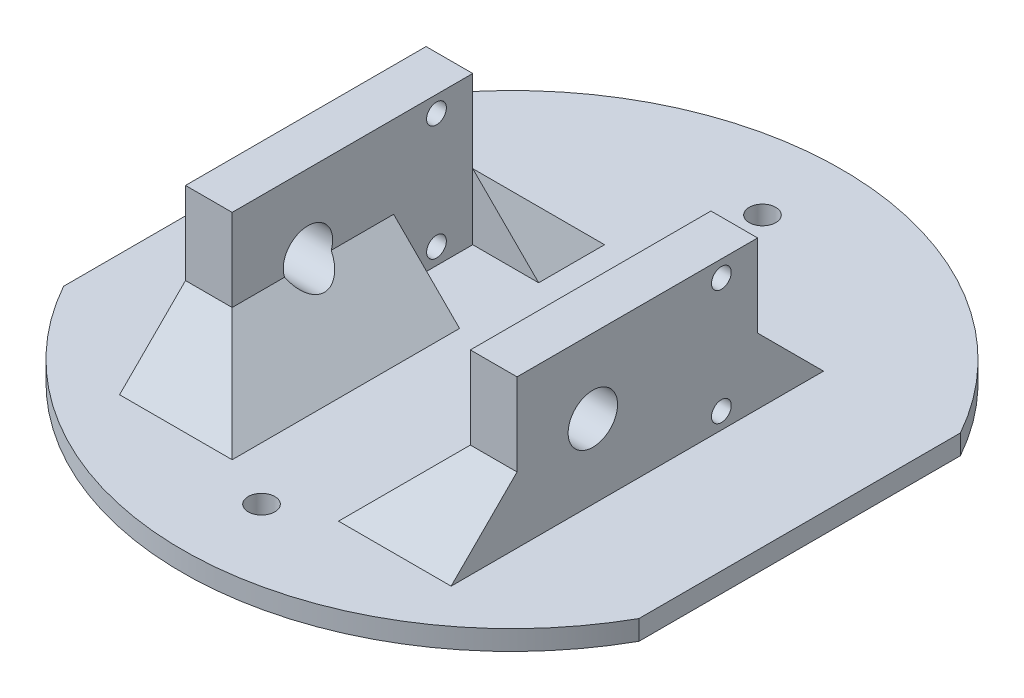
SolidWorks part; units mm, degrees
ref_plane "Front Plane" through (0, 0, 0) normal (0, 0, 1) x (1, 0, 0)
ref_plane "Top Plane" through (0, 0, 0) normal (0, 1, 0) x (1, 0, 0)
ref_plane "Right Plane" through (0, 0, 0) normal (1, 0, 0) x (0, 0, -1)
sketch "Sketch2" plane through (0, 0, 0) normal (0, 1, 0) x (1, 0, 0)
  circle A0 centre (0, 0) radius 50
  dimension "D1" = 100
extrude "Boss-Extrude1" add sketch "Sketch2" along normal blind 3
sketch "Sketch3" plane through (0, 3, 0) normal (0, 1, 0) x (1, 0, 0)
  line L0 (0, 0) -> (0, 50) construction
  line L1 (0, 0) -> (0, -50) construction
  circle A0 centre (0, 0) radius 50 construction
  point P2 (0, -38)
  point P9 (0, 38)
  dimension "D2" = 12
  dimension "D1" = 12
sketch "Sketch6" plane through (0, 3, 0) normal (0, 1, 0) x (1, 0, 0)
  line L0 (0, 0) -> (-50, 0) construction
  line L1 (-43.65, 0) -> (-43.65, 24.386) construction
  line L2 (0, 0) -> (50, 0) construction
  line L3 (43.65, 24.386) -> (43.65, 0) construction
  line L4 (-43.65, 24.386) -> (-43.65, -24.386)
  line L5 (43.65, 24.386) -> (43.65, -24.386)
  line L6 (-43.65, 24.386) -> (-50, 24.386)
  line L7 (-50, 24.386) -> (-50, 0)
  line L8 (-50, 0) -> (-50, -24.386)
  line L9 (-50, -24.386) -> (-43.65, -24.386)
  line L10 (43.65, -24.386) -> (50, -24.386)
  line L11 (50, -24.386) -> (50, 0)
  line L12 (50, 0) -> (50, 24.386)
  line L13 (50, 24.386) -> (43.65, 24.386)
  circle A0 centre (0, 0) radius 50 construction
  dimension "D1" = 6.35
  dimension "D2" = 6.35
extrude "Cut-Extrude1" cut sketch "Sketch6" against normal blind 38.1
sketch "Sketch9" plane through (0, 3, 0) normal (0, 1, 0) x (1, 0, 0)
  line L0 (-43.65, -24.386) -> (43.65, -24.386) construction
  line L1 (-43.65, -24.386) -> (-43.65, 24.386) construction
  line L2 (-25.15, -24.386) -> (-18.07, -24.386)
  line L3 (-25.15, -24.386) -> (-25.15, 12.114)
  line L4 (-25.15, 12.114) -> (-18.07, 12.114)
  line L5 (-18.07, -24.386) -> (-18.07, 12.114)
  line L6 (25.15, -24.386) -> (18.07, -24.386)
  line L7 (25.15, -24.386) -> (25.15, 12.114)
  line L8 (25.15, 12.114) -> (18.07, 12.114)
  line L9 (18.07, -24.386) -> (18.07, 12.114)
  line L10 (43.65, 24.386) -> (43.65, -24.386) construction
  dimension "D1" = 7.08
  dimension "D2" = 7.08
  dimension "D3" = 36.5
  dimension "D4" = 36.5
  dimension "D5" = 18.5
  dimension "D6" = 18.5
extrude "Boss-Extrude4" add sketch "Sketch9" along normal blind 22.5
hole_wizard "Tap Drill for #10-32 Tap2" positions "Sketch13" profile "Sketch14" hole size "#10-32" standard "ANSI Inch"
sketch "Sketch13" plane through (0, 3, 0) normal (0, 1, 0) x (1, 0, 0)
  point P0 (0, 38)
  point P3 (0, -38)
sketch "Sketch14" plane through (0, 3, -38) normal (1, 0, 0) x (0, 0, 1)
  line L0 (0, 0) -> (0, 3)
  line L1 (0, 3) -> (2.0193, 3)
  line L2 (2.0193, 3) -> (2.0193, 0)
  line L5 (2.0193, 0) -> (0, 0)
  line L11 (0, -6.35) -> (0, 107.95) construction
  dimension "Thru Hole Dia." = 4.0386
  dimension "Thru Hole Depth" = 3
sketch "Sketch17" plane through (-25.15, 0, 0) normal (-1, 0, 0) x (0, 0, 1)
  line L0 (-8.114, 5.5) -> (-5.114, 5.5) construction
  line L1 (-8.114, 23) -> (-5.114, 23) construction
  circle A1 centre (-6.614, 5.5) radius 1.5 construction
  circle A2 centre (-6.614, 5.5) radius 1.5
  circle A3 centre (-6.614, 23) radius 1.5 construction
  circle A4 centre (-6.614, 23) radius 1.5
extrude "Cut-Extrude3" cut sketch "Sketch17" against normal through all both and the other way through all
chamfer "Chamfer1" distance 10 angle 45 6 edges at (18.07, 3, 6.136) (-18.07, 3, 6.136) (-21.61, 3, 24.386) (-21.61, 3, -12.114) (21.61, 3, 24.386) (21.61, 3, -12.114)
ref_plane "Plane1" through (0, 13, 0) normal (0, -1, 0) x (-1, 0, 0)
sketch "Sketch19" plane through (0, 13, 0) normal (0, -1, 0) x (-1, 0, 0)
  line L0 (18.07, -24.386) -> (18.07, 12.114) construction
  line L1 (-18.07, 12.114) -> (18.07, 12.114)
  line L2 (-18.07, 12.114) -> (-18.07, 0.114)
  line L3 (-18.07, 0.114) -> (18.07, 0.114)
  line L4 (18.07, 12.114) -> (18.07, 0.114)
  dimension "D1" = 12
extrude "Cut-Extrude4" cut sketch "Sketch19" along normal up to surface (10 mm away)
sketch "Sketch20" plane through (25.15, 0, 0) normal (1, 0, 0) x (0, 0, -1)
  circle A0 centre (-12.886, 14.25) radius 3.75
extrude "Cut-Extrude5" cut sketch "Sketch20" against normal up to surface (50.3 mm away)
equation "\"2.2mmmm\"=10"
